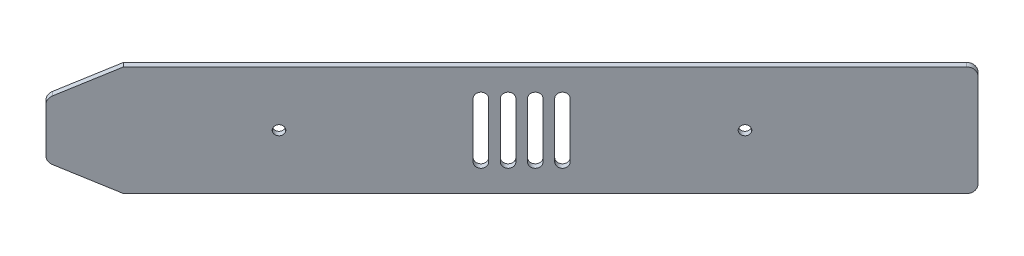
SolidWorks part; units mm, degrees
ref_plane "Plan de face" through (0, 0, 0) normal (0, 0, 1) x (1, 0, 0)
ref_plane "Plan de dessus" through (0, 0, 0) normal (0, 1, 0) x (1, 0, 0)
ref_plane "Plan de droite" through (0, 0, 0) normal (1, 0, 0) x (0, 0, -1)
sketch "Esquisse1" plane through (0, 0, 0) normal (0, 0, 1) x (1, 0, 0)
  line L0 (20, 45) -> (20, -5) construction
  line L1 (20, 0) -> (237, 0)
  line L2 (0, 11.8541) -> (0, 28.1459)
  line L3 (20, 40) -> (237, 40)
  line L4 (240, 3) -> (240, 37)
  line L5 (40, 45) -> (40, -5) construction
  line L6 (200, 45) -> (200, -5) construction
  line L7 (55, 20) -> (185, 20) construction
  line L8 (60, 25) -> (60, 15) construction
  line L9 (180, 25) -> (180, 15) construction
  line L10 (-7.2869, 10) -> (4.241, 10) construction
  line L11 (-7.2869, 30) -> (4.241, 30) construction
  line L12 (1.6584, 9.1708) -> (20, 0)
  line L13 (1.6584, 30.8292) -> (20, 40)
  circle A0 centre (60, 20) radius 1.75
  circle A1 centre (180, 20) radius 1.75
  arc A2 (1.6584, 30.8292) -> (0, 28.1459) centre (3, 28.1459) ccw
  arc A3 (1.6584, 9.1708) -> (0, 11.8541) centre (3, 11.8541) cw
  arc A4 (237, 0) -> (240, 3) centre (237, 3) ccw
  arc A5 (237, 40) -> (240, 37) centre (237, 37) cw
  point P30 (0, 30)
  point P33 (0, 10)
  dimension "D1" = 3
extrude "Extrusion1" add sketch "Esquisse1" along normal blind 2
sketch "Esquisse2" plane through (0, 0, 2) normal (0, 0, 1) x (1, 0, 0)
  line L0 (20, 40) -> (20, 0)
sketch "Esquisse10" plane through (0, 0, 0) normal (0, 0, -1) x (-1, 0, 0)
  line L0 (-179.7363, 30) -> (-88.1801, 30) construction
  line L1 (-176.4242, 10) -> (-88.1801, 10) construction
  line L2 (-133, 45.1957) -> (-133, -8.981) construction
  line L3 (-237, 40) -> (-20, 40) construction
  line L4 (-20, 0) -> (-237, 0) construction
  line L5 (-128, 30) -> (-128, 10)
  line L6 (-135, 30) -> (-135, 10)
  line L7 (-131, 30) -> (-131, 10)
  line L8 (-124, 30) -> (-124, 10)
  line L9 (-121, 30) -> (-121, 10)
  line L10 (-117, 30) -> (-117, 10)
  line L11 (-114, 30) -> (-114, 10)
  line L12 (-110, 30) -> (-110, 10)
  circle A0 centre (-180, 20) radius 1.75 construction
  arc A1 (-135, 30) -> (-131, 30) centre (-133, 30) cw
  arc A2 (-131, 10) -> (-135, 10) centre (-133, 10) cw
  arc A3 (-128, 30) -> (-124, 30) centre (-126, 30) cw
  arc A4 (-124, 10) -> (-128, 10) centre (-126, 10) cw
  arc A5 (-121, 30) -> (-117, 30) centre (-119, 30) cw
  arc A6 (-117, 10) -> (-121, 10) centre (-119, 10) cw
  arc A7 (-114, 30) -> (-110, 30) centre (-112, 30) cw
  arc A8 (-110, 10) -> (-114, 10) centre (-112, 10) cw
  dimension "D3" = 47
  dimension "D1" = 10
  dimension "D2" = 10
extrude "Enlèv. mat.-Extru.1" cut sketch "Esquisse10" against normal blind 10
sheet metal parameters "Tôlerie 1" parameters "D1"=0.7366
flatten bends "Dépliage 1" parameters "D1"=0
sketch "Esquisse-Angle1" plane through (0, 0, 2) normal (0, 0, 1) x (1, 0, 0)
process bends "Pliage 1" parameters "D1"=0
sketch "Esquisse-Plate1" plane through (0, 0, 2) normal (0, 0, 1) x (1, 0, 0)
sketched bend "Pli esquissé1" parameters "D1"=0.7366
bend "Pli esquissé2" bend radius 0.7366 bend angle 45 parameters "D5"=1
sketch "Esquisse8" plane through (0, 0, 0) normal (0, 0, -1) x (-1, 0, 0)
  line L0 (-40, 40) -> (-40, 0)
  line L1 (-237, 40) -> (-20.682, 40) construction
  line L2 (-20.682, 0) -> (-237, 0) construction
  line L3 (-240, 3) -> (-240, 37) construction
  dimension "D1" = 200
sketched bend "Pli esquissé3" parameters "D1"=0.7366
bend "Pli esquissé4" bend radius 0.7366 bend angle 45 parameters "D5"=2
sketch "Esquisse9" plane through (21.2258, 0, 21.2258) normal (0.7071, 0, 0.7071) x (0.7071, 0, -0.7071)
  line L0 (187.6409, 40) -> (187.6409, 0)
  line L1 (224.6409, 40) -> (28.3229, 40) construction
  line L2 (28.3229, 0) -> (224.6409, 0) construction
  circle A0 centre (167.6409, 20) radius 1.75 construction
  dimension "D1" = 20
sketched bend "Pli esquissé5" parameters "D1"=0.7366
bend "Pli esquissé6" bend radius 0.7366 bend angle 30 parameters "D5"=3
flat pattern "Etat déplié1"
sketch "Lignes de pliage1" plane through (21.2258, 0, 21.2258) normal (0.7071, 0, 0.7071) x (0.7071, 0, -0.7071)
  line L0 (187.6409, 0) -> (187.6409, 40) construction
  line L1 (27.6409, 40) -> (27.6409, 0) construction
  line L2 (7.6409, 0) -> (7.6409, 40) construction
bend of the flat pattern "Dépliage-<Pli esquissé2>1"
bend of the flat pattern "Dépliage-<Pli esquissé4>1"
bend of the flat pattern "Dépliage-<Pli esquissé6>1"
